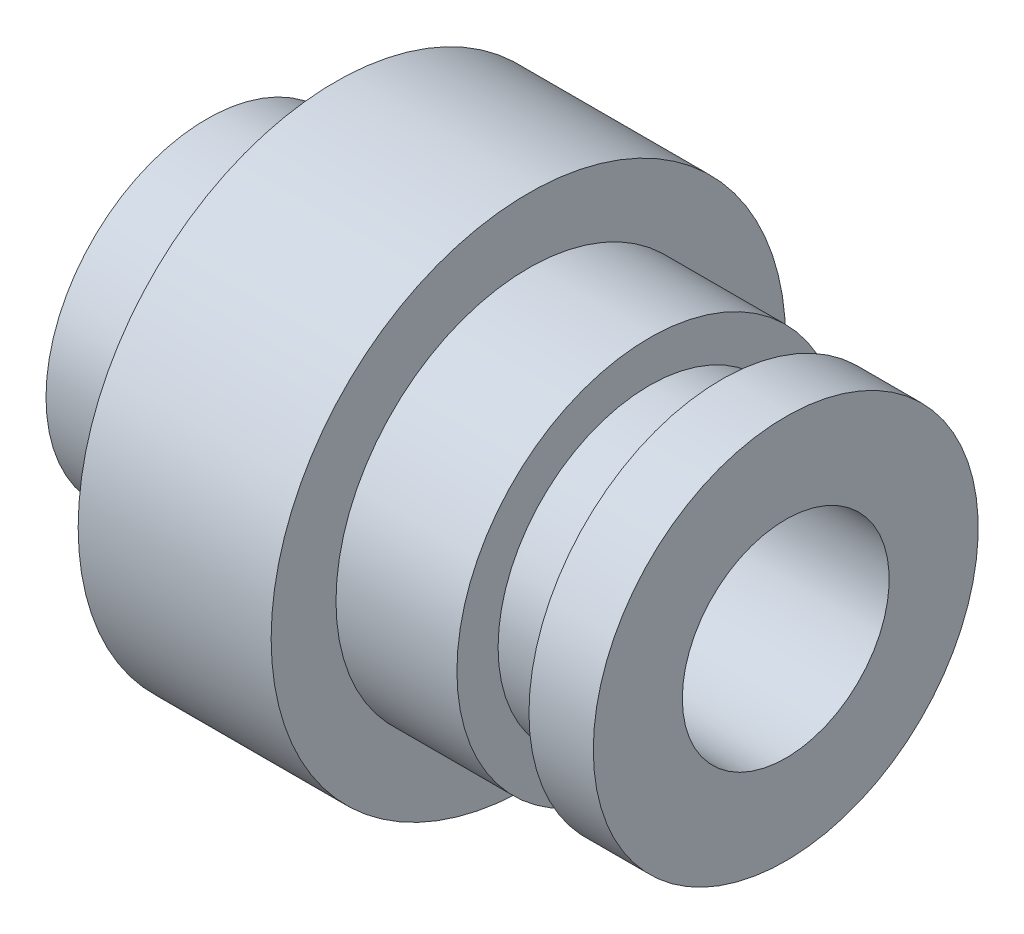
SolidWorks part; units mm, degrees
ref_plane "Front Plane" through (0, 0, 0) normal (0, 0, 1) x (1, 0, 0)
ref_plane "Top Plane" through (0, 0, 0) normal (0, 1, 0) x (1, 0, 0)
ref_plane "Right Plane" through (0, 0, 0) normal (1, 0, 0) x (0, 0, -1)
sketch "Sketch1" plane through (0, 0, 0) normal (0, 0, 1) x (1, 0, 0)
  line L0 (0, 0) -> (40.8653, 0) construction
  line L1 (0, 6.35) -> (-12.7, 6.35)
  line L2 (0, 6.35) -> (0, 5.1054)
  line L3 (0, 5.1054) -> (15.875, 5.1054)
  line L4 (15.875, 5.1054) -> (15.875, 9.4996)
  line L5 (15.875, 9.4996) -> (12.7, 9.4996)
  line L6 (12.7, 9.4996) -> (12.7, 7.4676)
  line L7 (12.7, 7.4676) -> (9.144, 7.4676)
  line L8 (9.144, 7.4676) -> (9.144, 9.4996)
  line L9 (3.175, 12.7) -> (-6.35, 12.7)
  line L10 (-12.7, 7.9375) -> (-12.7, 6.35)
  line L11 (9.144, 9.4996) -> (3.175, 9.4996)
  line L12 (3.175, 9.4996) -> (3.175, 12.7)
  line L13 (-12.7, 7.9375) -> (-6.35, 7.9375)
  line L14 (-6.35, 7.9375) -> (-6.35, 12.7)
  dimension "D1" = 10.2108
  dimension "D2" = 12.7
  dimension "D3" = 12.7
  dimension "D4" = 14.9352
  dimension "D5" = 18.9992
  dimension "D6" = 3.556
  dimension "D7" = 25.4
  dimension "D8" = 6.35
  dimension "D10" = 15.875
  dimension "D11" = 15.875
  dimension "D12" = 28.575
  dimension "D13" = 3.175
revolve "Revolve1" add sketch "Sketch1" angle 360 about L0
fillet "Fillet1" radius 3.175 1 edges at (-6.35, 0, 7.9375)
